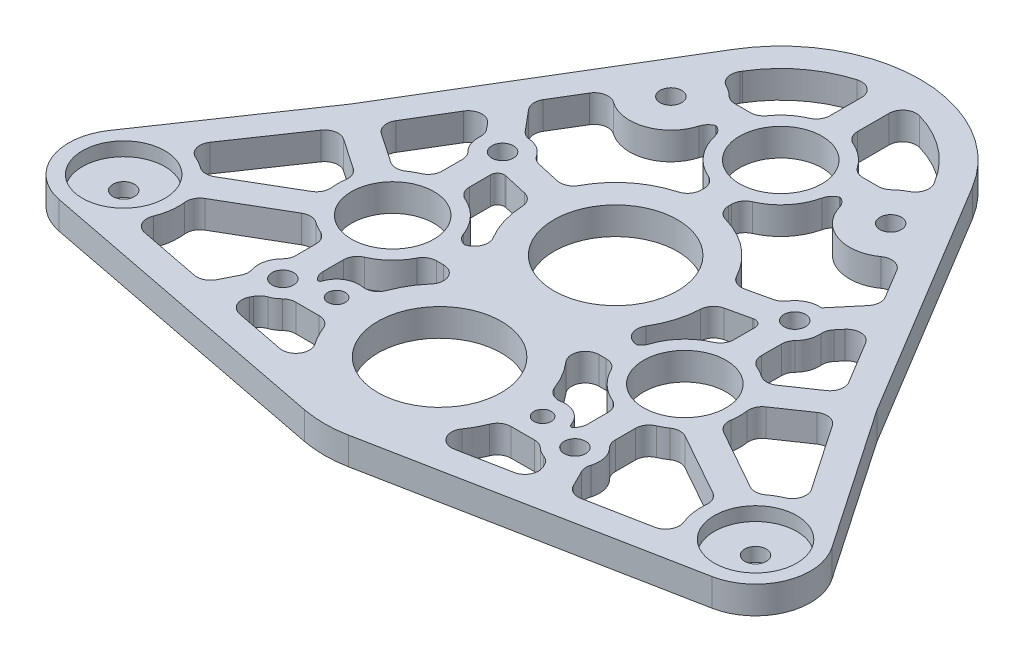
SolidWorks part; units mm, degrees
ref_plane "Front" through (0, 0, 0) normal (0, 0, 1) x (1, 0, 0)
ref_plane "Top" through (0, 0, 0) normal (0, 1, 0) x (1, 0, 0)
ref_plane "Right" through (0, 0, 0) normal (1, 0, 0) x (0, 0, -1)
sketch "Sketch2" plane through (0, 0, 0) normal (0, 1, 0) x (1, 0, 0)
  line L1 (0, 0) -> (254, 0)
  line L2 (0, 0) -> (0, 254)
  line L3 (0, 254) -> (254, 254)
  line L4 (254, 0) -> (254, 254)
  dimension "D1" = 254
  dimension "D2" = 254
extrude "Boss-Extrude1" add sketch "Sketch2" along normal blind 6.35
sketch "Sketch3" plane through (0, 6.35, 0) normal (0, 1, 0) x (1, 0, 0)
  circle A0 centre (124.5978, 148.128) radius 30.5371 construction
  circle A1 centre (124.5978, 107.4308) radius 25.4 construction
  circle A2 centre (124.5978, 148.128) radius 15.2972 construction
  circle A3 centre (124.5978, 186.2851) radius 7.62 construction
  circle A4 centre (90.8362, 130.348) radius 7.62 construction
  circle A5 centre (158.3593, 130.348) radius 7.62 construction
  circle A6 centre (158.3593, 130.348) radius 32.258 construction
  circle A7 centre (124.5978, 186.2851) radius 32.258 construction
  circle A8 centre (90.8362, 130.348) radius 32.258 construction
  circle A9 centre (124.5978, 186.2851) radius 9.5313
  circle A10 centre (90.8362, 130.348) radius 9.5314
  circle A11 centre (158.3593, 130.348) radius 9.5314
  circle A12 centre (124.5978, 148.128) radius 14.2748
  circle A13 centre (124.5978, 107.4308) radius 14.2748
  dimension "D1" = 61.0743
  dimension "D2" = 50.8
  dimension "D3" = 30.5943
  dimension "D4" = 15.24
  dimension "D5" = 15.24
  dimension "D6" = 15.24
  dimension "D7" = 64.516
  dimension "D9" = 28.5496
  dimension "D10" = 17.78
  dimension "D8" = 19.0627
sketch "Sketch4" plane through (0, 6.35, 0) normal (0, 1, 0) x (1, 0, 0)
extrude "Cut-Extrude1" cut sketch "Sketch3" against normal through all
sketch "Sketch5" plane through (0, 6.35, 0) normal (0, 1, 0) x (1, 0, 0)
  line L0 (63.6985, 147.7898) -> (96.9773, 202.9491)
  line L1 (152.2182, 202.9491) -> (185.7509, 147.369)
  line L2 (49.1432, 94.9654) -> (119.4957, 81.2534)
  line L4 (129.6998, 81.2534) -> (200.0523, 94.9654)
  line L5 (185.7509, 147.369) -> (208.114, 114.5879)
  line L6 (41.0933, 114.6052) -> (63.6985, 147.7898)
  arc A0 (152.2182, 202.9491) -> (96.9773, 202.9491) centre (124.5978, 186.2851) ccw
  arc A3 (119.4957, 81.2534) -> (129.6998, 81.2534) centre (124.5978, 107.4308) ccw
  circle A4 centre (51.5728, 107.4308) radius 9.525 construction
  circle A5 centre (197.6228, 107.4308) radius 9.525 construction
  arc A6 (41.0933, 114.6052) -> (49.1432, 94.9654) centre (51.5728, 107.4308) ccw
  arc A7 (200.0523, 94.9654) -> (208.114, 114.5879) centre (197.6228, 107.4308) ccw
  circle A9 centre (51.5728, 107.4308) radius 12.7 construction
  circle A10 centre (197.6228, 107.4308) radius 12.7 construction
  point P17 (209.7678, 111.1693)
  point P24 (63.7178, 111.1693)
  dimension "D1" = 64.516
  dimension "D2" = 53.34
  dimension "D3" = 19.05
  dimension "D4" = 73.025
  dimension "D6" = 73.025
  dimension "D7" = 3.175
extrude "Cut-Extrude3" cut sketch "Sketch5" against normal through all flip side to cut
sketch "Sketch11" plane through (0, 6.35, 0) normal (0, 1, 0) x (1, 0, 0)
  circle A0 centre (51.5728, 107.4308) radius 9.5314
  circle A1 centre (197.6228, 107.4308) radius 9.5313
  dimension "D1" = 19.0627
extrude "Cut-Extrude4" cut sketch "Sketch11" against normal blind 3.175
hole_wizard "#9 (0.196) Diameter Hole1" positions "Sketch12" profile "Sketch13" hole size "#9" standard "ANSI Inch"
sketch "Sketch12" plane through (0, 6.35, 0) normal (0, 1, 0) x (1, 0, 0)
  circle A0 centre (124.5978, 186.2851) radius 25.4 construction
  circle A1 centre (90.8362, 130.348) radius 25.4 construction
  circle A2 centre (158.3593, 130.348) radius 25.4 construction
  point P13 (197.6228, 107.4308)
  point P16 (51.5728, 107.4308)
  point P19 (90.8362, 104.948)
  point P21 (90.8362, 155.748)
  point P23 (158.3593, 155.748)
  point P25 (158.3593, 104.948)
  point P29 (99.1978, 186.2851)
  point P33 (149.9978, 186.2851)
  dimension "D1" = 50.8
sketch "Sketch13" plane through (197.6228, 6.35, -107.4308) normal (1, 0, 0) x (0, 0, 1)
  line L0 (0, 0) -> (0, 6.35)
  line L1 (0, 6.35) -> (2.4892, 6.35)
  line L2 (2.4892, 6.35) -> (2.4892, 0)
  line L5 (2.4892, 0) -> (0, 0)
  line L11 (0, -6.35) -> (0, 107.95) construction
  dimension "Thru Hole Dia." = 4.9784
  dimension "Thru Hole Depth" = 6.35
hole_wizard "#10-32 Tapped Hole1" positions "Sketch17" profile "Sketch16" tap size "#10-32" standard "ANSI Inch"
sketch "Sketch17" plane through (0, 6.35, 0) normal (0, 1, 0) x (1, 0, 0)
  circle A0 centre (124.5978, 107.4308) radius 23.8125
  point P5 (100.7853, 107.4308)
  point P7 (148.4103, 107.4308)
  dimension "D1" = 47.625
sketch "Sketch16" plane through (100.7853, 6.35, -107.4308) normal (1, 0, 0) x (0, 0, 1)
  line L0 (0, 0) -> (0, 13.2428)
  line L1 (0, 13.2428) -> (2.0193, 12.0294)
  line L2 (2.0193, 12.0294) -> (2.0193, 0)
  line L5 (2.0193, 0) -> (0, 0)
  line L10 (0, 13.2428) -> (-2.0193, 12.0294) construction
  line L11 (0, -6.35) -> (0, 107.95) construction
  dimension "Tap Drill Dia." = 4.0386
  dimension "Tap Drill Depth" = 12.0294
  dimension "Drill Angle" = 118
sketch "Sketch14" plane through (0, 6.35, 0) normal (0, 1, 0) x (1, 0, 0)
  line L0 (101.702, 189.0703) -> (152.502, 189.0703) construction
  line L1 (90.8649, 155.748) -> (90.8649, 143.0543) construction
  line L2 (158.3306, 155.748) -> (158.3306, 104.948) construction
  line L3 (124.5978, 148.128) -> (158.3306, 155.748) construction
  line L4 (124.5978, 148.128) -> (90.8649, 155.748) construction
  line L5 (87.784, 128.553) -> (62.5407, 113.8461) construction
  line L6 (158.3306, 129.496) -> (197.6228, 107.4308) construction
  line L7 (101.702, 189.0703) -> (124.5978, 148.128) construction
  line L8 (124.5978, 148.128) -> (152.502, 189.0703) construction
  line L9 (43.0398, 10.0245) -> (90.8649, 104.948) construction
  line L10 (163.6613, 94.3675) -> (158.3306, 104.948) construction
  line L11 (158.3306, 155.748) -> (167.0215, 166.0952) construction
  line L12 (163.8, 157.3232) -> (168.7637, 163.2329)
  line L13 (149.1329, 195.7708) -> (146.7811, 199.6688)
  line L14 (91.2097, 181.0971) -> (83.8961, 168.9749)
  line L15 (121.4228, 211.9978) -> (121.4228, 198.5884)
  line L17 (158.9236, 161.384) -> (165.2994, 168.9749)
  line L18 (153.0871, 157.8185) -> (143.7839, 155.717)
  line L20 (165.2994, 168.9749) -> (157.9859, 181.0971)
  line L21 (127.7728, 211.9978) -> (127.7728, 198.5884)
  line L22 (106.6276, 192.2453) -> (113.376, 192.2453)
  line L23 (90.8362, 155.748) -> (82.174, 166.0952) construction
  line L24 (154.4779, 151.6227) -> (145.1831, 149.523)
  line L25 (104.0124, 149.523) -> (94.7176, 151.6227)
  line L26 (160.7618, 153.7059) -> (169.4527, 164.0531) construction
  line L29 (160.4356, 93.7134) -> (157.6036, 99.3344)
  line L30 (70.6878, 147.0822) -> (81.9382, 139.4185)
  line L31 (124.5978, 212.1677) -> (124.5978, 87.1362) construction
  line L32 (158.3306, 104.948) -> (93.3254, 104.948) construction
  line L33 (69.0451, 144.3596) -> (90.8649, 129.496) construction
  line L34 (90.8649, 129.496) -> (158.3306, 129.496) construction
  line L35 (158.3306, 129.496) -> (180.4054, 143.9369) construction
  line L36 (153.6596, 101.7862) -> (144.5002, 101.7588)
  line L37 (180.4054, 143.9369) -> (146.7811, 199.6688)
  line L38 (202.8684, 111.0093) -> (180.4054, 143.9369)
  line L39 (128.4851, 87.4861) -> (198.8375, 101.1981)
  line L40 (50.358, 101.1981) -> (120.7104, 87.4861)
  line L41 (69.0451, 144.3596) -> (46.3365, 111.0231)
  line L42 (102.4144, 199.6688) -> (69.0451, 144.3596)
  line L43 (178.5088, 147.0805) -> (168.7637, 163.2329)
  line L44 (196.666, 120.1011) -> (181.9177, 141.72)
  line L45 (132.3339, 88.2363) -> (160.4356, 93.7134)
  line L46 (61.1606, 99.0926) -> (82.2852, 94.9753)
  line L47 (67.2576, 141.7355) -> (52.5208, 120.1017)
  line L48 (102.4144, 199.6688) -> (100.0626, 195.7708)
  line L49 (161.5073, 118.0378) -> (161.5145, 109.652)
  line L50 (155.1574, 118.0517) -> (155.1647, 109.6253)
  line L51 (67.2576, 141.7355) -> (78.6571, 133.9703)
  line L52 (87.6899, 151.038) -> (87.6899, 142.6586)
  line L53 (82.2852, 94.9753) -> (85.9054, 102.1606)
  line L54 (153.6596, 108.1097) -> (153.56, 108.1097)
  line L55 (155.1647, 151.0706) -> (155.1574, 142.6443)
  line L56 (166.9034, 94.974) -> (163.2984, 102.1752)
  line L57 (87.6882, 118.0378) -> (87.681, 109.652)
  line L59 (104.6953, 101.7588) -> (95.5359, 101.7862)
  line L61 (155.1556, 155.748) -> (155.1556, 104.1933) construction
  line L62 (90.2525, 161.382) -> (83.8961, 168.9749)
  line L63 (88.7668, 93.7121) -> (91.5893, 99.334)
  line L64 (167.2622, 139.4138) -> (178.5088, 147.0805)
  line L65 (170.5441, 133.9508) -> (181.9177, 141.72)
  line L66 (166.9572, 120.9924) -> (185.3438, 110.6988)
  line L68 (78.6094, 126.8903) -> (60.5925, 116.3805)
  line L69 (67.2576, 141.7355) -> (89.0775, 126.872) construction
  line L70 (170.4185, 126.3447) -> (188.4542, 116.2279)
  line L71 (90.8649, 129.496) -> (90.8649, 104.948) construction
  line L72 (87.6899, 155.748) -> (87.6899, 105.7026) construction
  line L73 (103.3284, 132.671) -> (110.9308, 132.671)
  line L74 (90.8649, 155.748) -> (90.8649, 104.948) construction
  line L76 (127.7728, 212.1677) -> (127.7728, 87.1362) construction
  line L77 (102.8876, 126.321) -> (116.1457, 126.321)
  line L78 (94.0381, 118.0517) -> (94.0308, 109.6253)
  line L79 (95.6372, 108.1225) -> (95.5272, 108.1225)
  line L80 (81.8181, 121.3968) -> (63.7951, 110.9044)
  line L81 (160.8258, 92.9389) -> (155.1556, 104.1933) construction
  line L82 (161.5145, 151.044) -> (161.5073, 142.6582)
  line L83 (133.0499, 126.321) -> (146.3079, 126.321)
  line L85 (138.2647, 132.671) -> (145.8671, 132.671)
  line L88 (166.9034, 94.974) -> (188.0349, 99.0926)
  line L90 (88.7668, 93.7121) -> (116.8616, 88.2363)
  line L91 (40.2043, 11.4531) -> (87.6899, 105.7026) construction
  line L92 (105.4116, 155.717) -> (96.1084, 157.8185)
  line L93 (160.8091, 153.0529) -> (124.5978, 144.873) construction
  line L94 (124.5978, 144.873) -> (88.3864, 153.0529) construction
  line L95 (166.4884, 171.0413) -> (160.8091, 153.0529) construction
  line L96 (85.3907, 157.3066) -> (80.4308, 163.2313)
  line L100 (94.0308, 151.0706) -> (94.0381, 142.6443)
  line L101 (80.4308, 163.2313) -> (70.6878, 147.0822)
  line L102 (121.4228, 173.9818) -> (121.4228, 168.5147)
  line L103 (55.8366, 256.1512) -> (88.3864, 153.0529) construction
  line L104 (127.7728, 173.9818) -> (127.7728, 168.5147)
  line L105 (88.4017, 153.7099) -> (79.7395, 164.0571) construction
  line L106 (108.7148, 185.8953) -> (111.8974, 185.8953)
  line L108 (101.702, 192.2453) -> (152.502, 192.2453) construction
  line L109 (135.8195, 192.2453) -> (142.5679, 192.2453)
  line L110 (137.2981, 185.8953) -> (140.4807, 185.8953)
  line L111 (58.8642, 257.107) -> (90.8649, 155.748) construction
  line L112 (163.4607, 171.9972) -> (158.3306, 155.748) construction
  line L113 (158.3306, 155.748) -> (124.5978, 148.128) construction
  arc A0 (146.3079, 126.321) -> (155.1574, 118.0517) centre (158.3593, 130.348) ccw
  arc A1 (167.2622, 139.4138) -> (161.5073, 142.6582) centre (158.3593, 130.348) ccw
  arc A2 (170.4185, 126.3447) -> (170.5441, 133.9508) centre (158.3593, 130.348) ccw
  arc A3 (161.5073, 118.0378) -> (166.9572, 120.9924) centre (158.3593, 130.348) ccw
  arc A4 (155.1647, 109.6253) -> (153.6596, 108.1097) centre (158.3593, 104.948) ccw
  arc A5 (163.2984, 102.1752) -> (161.5145, 109.652) centre (158.3593, 104.948) ccw
  arc A6 (104.6953, 101.7588) -> (116.8616, 88.2363) centre (124.5978, 107.4308) ccw
  arc A7 (144.9302, 111.287) -> (133.0499, 126.321) centre (124.5978, 107.4308) ccw
  circle A8 centre (124.5978, 107.4308) radius 23.8125 construction
  arc A9 (132.3339, 88.2363) -> (144.5002, 101.7588) centre (124.5978, 107.4308) ccw
  circle A10 centre (99.1978, 186.2851) radius 2.4892 construction
  arc A11 (91.2097, 181.0971) -> (108.7148, 185.8953) centre (99.1978, 186.2851) ccw
  arc A12 (87.681, 109.652) -> (85.9054, 102.1606) centre (90.8362, 104.948) ccw
  circle A13 centre (90.8362, 155.748) radius 5.6642
  arc A14 (94.0308, 151.0706) -> (94.7176, 151.6227) centre (90.8362, 155.748) ccw
  arc A15 (95.5272, 108.1225) -> (94.0308, 109.6253) centre (90.8362, 104.948) ccw
  circle A16 centre (149.9978, 186.2851) radius 2.4892 construction
  arc A17 (149.1329, 195.7708) -> (142.5679, 192.2453) centre (149.9978, 186.2851) ccw
  arc A18 (94.0381, 118.0517) -> (102.8876, 126.321) centre (90.8362, 130.348) ccw
  circle A19 centre (90.8362, 104.948) radius 5.6642
  arc A20 (91.5893, 99.334) -> (95.5359, 101.7862) centre (90.8362, 104.948) ccw
  arc A21 (103.3284, 132.671) -> (94.0381, 142.6443) centre (90.8362, 130.348) ccw
  circle A22 centre (158.3593, 104.948) radius 5.6642
  arc A23 (153.6596, 101.7862) -> (157.6036, 99.3344) centre (158.3593, 104.948) ccw
  arc A24 (106.6276, 192.2453) -> (100.0626, 195.7708) centre (99.1978, 186.2851) ccw
  circle A25 centre (90.8362, 104.948) radius 2.4892 construction
  arc A26 (138.2647, 132.671) -> (145.1831, 149.523) centre (124.5978, 148.128) ccw
  circle A27 centre (158.3593, 155.748) radius 5.6642
  arc A28 (198.8375, 101.1981) -> (202.8684, 111.0093) centre (197.6228, 107.4308) ccw
  arc A29 (120.7104, 87.4861) -> (128.4851, 87.4861) centre (124.5978, 107.4308) ccw
  arc A30 (46.3365, 111.0231) -> (50.358, 101.1981) centre (51.5728, 107.4308) ccw
  arc A31 (146.7811, 199.6688) -> (102.4144, 199.6688) centre (124.5978, 186.2851) ccw
  arc A32 (60.5925, 116.3805) -> (52.5208, 120.1017) centre (51.5728, 107.4308) ccw
  circle A33 centre (124.5978, 148.128) radius 14.2748 construction
  arc A34 (78.6571, 133.9703) -> (78.6094, 126.8903) centre (90.8362, 130.348) ccw
  arc A35 (146.7811, 199.6688) -> (127.7728, 211.9978) centre (124.5978, 186.2851) ccw
  arc A36 (161.5145, 151.044) -> (163.8, 157.3232) centre (158.3593, 155.748) ccw
  arc A37 (85.3907, 157.3066) -> (87.6899, 151.038) centre (90.8362, 155.748) ccw
  circle A38 centre (124.5978, 186.2851) radius 12.7063
  arc A39 (127.7728, 173.9818) -> (137.2981, 185.8953) centre (124.5978, 186.2851) ccw
  arc A40 (96.1084, 157.8185) -> (90.2525, 161.382) centre (90.8362, 155.748) ccw
  arc A41 (104.0124, 149.523) -> (110.9308, 132.671) centre (124.5978, 148.128) ccw
  arc A42 (116.1457, 126.321) -> (104.2653, 111.287) centre (124.5978, 107.4308) ccw
  arc A43 (143.7839, 155.717) -> (127.7728, 168.5147) centre (124.5978, 148.128) ccw
  circle A44 centre (90.8362, 130.348) radius 12.7064
  arc A45 (81.8181, 121.3968) -> (87.6882, 118.0378) centre (90.8362, 130.348) ccw
  circle A47 centre (51.5728, 107.4308) radius 12.7064
  arc A48 (61.1606, 99.0926) -> (63.7951, 110.9044) centre (51.5728, 107.4308) ccw
  arc A49 (111.8974, 185.8953) -> (121.4228, 173.9818) centre (124.5978, 186.2851) ccw
  arc A52 (135.8195, 192.2453) -> (127.7728, 198.5884) centre (124.5978, 186.2851) ccw
  circle A53 centre (158.3593, 130.348) radius 12.7064
  arc A54 (155.1574, 142.6443) -> (145.8671, 132.671) centre (158.3593, 130.348) ccw
  arc A55 (121.4228, 198.5884) -> (113.376, 192.2453) centre (124.5978, 186.2851) ccw
  circle A56 centre (197.6228, 107.4308) radius 12.7063
  arc A57 (196.666, 120.1011) -> (188.4542, 116.2279) centre (197.6228, 107.4308) ccw
  arc A58 (140.4807, 185.8953) -> (157.9859, 181.0971) centre (149.9978, 186.2851) ccw
  arc A59 (121.4228, 211.9978) -> (102.4144, 199.6688) centre (124.5978, 186.2851) ccw
  arc A60 (156.7175, 161.169) -> (153.0871, 157.8185) centre (158.3593, 155.748) ccw
  arc A61 (154.4779, 151.6227) -> (155.1647, 151.0706) centre (158.3593, 155.748) ccw
  arc A62 (158.9236, 161.384) -> (156.7175, 161.169) centre (158.3593, 155.748) ccw
  arc A63 (87.6899, 142.6586) -> (81.9382, 139.4185) centre (90.8362, 130.348) ccw
  arc A64 (185.3438, 110.6988) -> (188.0349, 99.0926) centre (197.6228, 107.4308) ccw
  arc A65 (121.4228, 168.5147) -> (105.4116, 155.717) centre (124.5978, 148.128) ccw
  circle A67 centre (100.7853, 107.4308) radius 5.1943
  arc A68 (104.2653, 111.287) -> (95.6372, 108.1225) centre (100.7853, 107.4308) ccw
  circle A70 centre (148.4103, 107.4308) radius 5.1943
  arc A71 (153.56, 108.1097) -> (144.9302, 111.287) centre (148.4103, 107.4308) ccw
  point P84 (121.4228, 212.1677)
  point P88 (121.4228, 87.1362)
  point P89 (99.1978, 183.0847)
  point P90 (149.9978, 183.0847)
  point P92 (155.852, 158.4431)
  point P93 (124.5978, 151.383)
  point P94 (93.3435, 158.4431)
  point P95 (61.8919, 258.0629)
  point P105 (160.1198, 126.8496)
  point P110 (90.8649, 127.173)
  point P111 (158.3306, 127.173)
  point P112 (160.8198, 108.123)
  point P113 (88.3757, 108.123)
  point P114 (156.7786, 126.7026)
  point P115 (196.0708, 104.6864)
  point P116 (89.2667, 133.0913)
  point P117 (49.9745, 110.1996)
  point P128 (90.8649, 133.523)
  point P129 (158.3306, 133.523)
  point P134 (92.4632, 127.6046)
  point P135 (53.171, 104.7128)
  point P136 (70.8445, 146.9737)
  point P137 (92.6542, 132.0953)
  point P138 (94.0399, 155.748)
  point P139 (94.0399, 104.1933)
  dimension "D18" = 3.175
  dimension "D9" = 47.625
  dimension "D4" = 9.525
  dimension "D19" = 3.175
  dimension "D20" = 3.175
  dimension "D15" = 3.175
  dimension "D21" = 3.175
  dimension "D1" = 6.35
  dimension "D3" = 3.175
  dimension "D5" = 3.175
  dimension "D6" = 3.175
  dimension "D7" = 3.175
  dimension "D8" = 3.175
  dimension "D10" = 3.175
  dimension "D11" = 3.175
  dimension "D12" = 3.175
  dimension "D13" = 3.175
  dimension "D14" = 3.175
  dimension "D16" = 3.175
  dimension "D17" = 3.175
extrude "Cut-Extrude5" cut sketch "Sketch14" against normal through all
fillet "Fillet1" radius 3.175 48 edges at (149.1329, 3.175, -195.7708) (121.4228, 3.175, -198.5884) (113.376, 3.175, -192.2453) (121.4228, 3.175, -173.9818) (121.4228, 3.175, -168.5147) (110.9308, 3.175, -132.671) (85.3907, 3.175, -157.3066) (87.6899, 3.175, -151.038) (87.6899, 3.175, -142.6586) (78.6571, 3.175, -133.9703) (78.6094, 3.175, -126.8903) (155.1574, 3.175, -142.6443) (153.0871, 3.175, -157.8185) (178.5088, 3.175, -147.0805) (165.2994, 3.175, -168.9749) (196.666, 3.175, -120.1011) (181.9177, 3.175, -141.72) (161.5073, 3.175, -118.0378) (166.9572, 3.175, -120.9924) (185.3438, 3.175, -110.6988) (153.6596, 3.175, -108.1097) (155.1647, 3.175, -109.6253) (155.1574, 3.175, -118.0517) (146.3079, 3.175, -126.321) (116.1457, 3.175, -126.321) (94.0381, 3.175, -118.0517) (63.7951, 3.175, -110.9044) (87.681, 3.175, -109.652) (85.9054, 3.175, -102.1606) (87.6882, 3.175, -118.0378) (188.4542, 3.175, -116.2279) (188.0349, 3.175, -99.0926) (163.2984, 3.175, -102.1752) (161.5145, 3.175, -109.652) (170.5441, 3.175, -133.9508) (170.4185, 3.175, -126.3447) (94.0381, 3.175, -142.6443) (103.3284, 3.175, -132.671) (138.2647, 3.175, -132.671) (166.9034, 3.175, -94.974) (132.3339, 3.175, -88.2363) (95.5272, 3.175, -108.1225) (94.0308, 3.175, -109.6253) (52.5208, 3.175, -120.1017) (82.2852, 3.175, -94.9753) (88.7668, 3.175, -93.7121) (61.1606, 3.175, -99.0926) (104.2653, 3.175, -111.287)
fillet "Fillet2" radius 3.175 14 edges at (145.1831, 3.175, -149.523) (168.7637, 3.175, -163.2329) (127.7728, 3.175, -173.9818) (137.2981, 3.175, -185.8953) (140.4807, 3.175, -185.8953) (157.9859, 3.175, -181.0971) (127.7728, 3.175, -211.9978) (94.7176, 3.175, -151.6227) (67.2576, 3.175, -141.7355) (80.4308, 3.175, -163.2313) (111.8974, 3.175, -185.8953) (108.7148, 3.175, -185.8953) (91.2097, 3.175, -181.0971) (154.4779, 3.175, -151.6227)
fillet "Fillet3" radius 3.175 33 edges at (142.5679, 3.175, -192.2453) (143.7839, 3.175, -155.717) (127.7728, 3.175, -198.5884) (135.8195, 3.175, -192.2453) (100.0626, 3.175, -195.7708) (106.6276, 3.175, -192.2453) (90.2525, 3.175, -161.382) (96.1084, 3.175, -157.8185) (105.4116, 3.175, -155.717) (81.9382, 3.175, -139.4185) (60.5925, 3.175, -116.3805) (81.8181, 3.175, -121.3968) (104.6953, 3.175, -101.7588) (91.5893, 3.175, -99.334) (95.5359, 3.175, -101.7862) (102.8876, 3.175, -126.321) (133.0499, 3.175, -126.321) (161.5073, 3.175, -142.6582) (167.2622, 3.175, -139.4138) (145.8671, 3.175, -132.671) (121.4228, 3.175, -211.9978) (104.0124, 3.175, -149.523) (116.8616, 3.175, -88.2363) (160.4356, 3.175, -93.7134) (70.6878, 3.175, -147.0822) (83.8961, 3.175, -168.9749) (127.7728, 3.175, -168.5147) (163.8, 3.175, -157.3232) (161.5145, 3.175, -151.044) (157.6036, 3.175, -99.3344) (153.6596, 3.175, -101.7862) (144.5002, 3.175, -101.7588) (144.9302, 3.175, -111.287)
fillet "Fillet4" radius 1.5875 2 edges at (94.0308, 3.175, -151.0706) (155.1647, 3.175, -151.0706)
fillet "Fillet5" radius 0.7937 2 edges at (95.6372, 3.175, -108.1225) (153.56, 3.175, -108.1097)
fillet "Fillet6" radius 0.3969 2 edges at (95.2035, 3.175, -108.5549) (153.9682, 3.175, -108.526)
fillet "Fillet7" radius 3.175 2 edges at (63.6985, 3.175, -147.7898) (185.7509, 3.175, -147.369)
